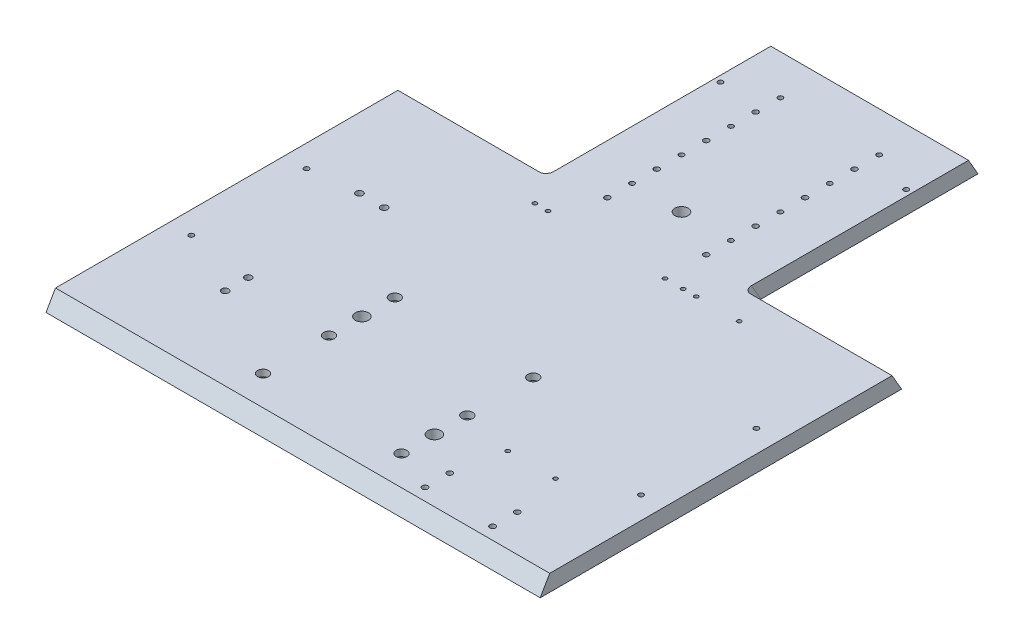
SolidWorks part; units mm, degrees
ref_plane "Front Plane" through (0, 0, 0) normal (0, 0, 1) x (1, 0, 0)
ref_plane "Top Plane" through (0, 0, 0) normal (0, 1, 0) x (1, 0, 0)
ref_plane "Right Plane" through (0, 0, 0) normal (1, 0, 0) x (0, 0, -1)
sketch "Sketch2" plane through (0, 0, 0) normal (0, 1, 0) x (1, 0, 0)
  line L0 (-60, 120) -> (60, 120)
  line L1 (60, 120) -> (60, -16.38)
  line L2 (60, -16.38) -> (150, -16.38)
  line L3 (150, -16.38) -> (150, -235.77)
  line L4 (150, -235.77) -> (-150, -235.77)
  line L5 (-150, -235.77) -> (-150, -16.38)
  line L6 (-150, -16.38) -> (-60, -16.38)
  line L7 (-60, -16.38) -> (-60, 120)
  dimension "D1" = 300
  dimension "D2" = 90
  dimension "D3" = 219.39
  dimension "D4" = 120
  dimension "D5" = 136.38
  dimension "D6" = 150
extrude "Boss-Extrude1" add sketch "Sketch2" along normal blind 10
sketch "Sketch3" plane through (0, 10, 0) normal (0, 1, 0) x (1, 0, 0)
  circle A0 centre (0, 0) radius 4
  dimension "D1" = 8
extrude "Cut-Extrude1" cut sketch "Sketch3" against normal through all
chamfer "Chamfer1" distance 10 angle 30 3 edges at (0, 10, -120) (-105, 10, 16.38) (105, 10, 16.38)
chamfer "Chamfer2" distance 10 angle 30 1 edges at (0, 10, 235.77)
hole_wizard "CBORE for M6 SHCS2" positions "Sketch5" profile "Sketch4" counterbore size "M6" standard "ANSI Metric"
sketch "Sketch5" plane through (0, 0, 0) normal (0, -1, 0) x (-1, 0, 0)
  point P0 (-42, -131.9965)
  point P3 (-42, -171.9965)
  point P6 (-42, -211.9965)
  point P9 (42, -171.9965)
  point P12 (42, -131.9965)
  point P15 (42, -211.9965)
sketch "Sketch4" plane through (42, 0, 131.9965) normal (1, 0, 0) x (0, 0, -1)
  line L0 (0, 0) -> (0, 10)
  line L1 (0, 10) -> (3.3, 10)
  line L3 (3.3, 10) -> (3.3, 6)
  line L4 (3.3, 6) -> (5.5, 6)
  line L5 (5.5, 6) -> (5.5, 0)
  line L7 (5.5, 0) -> (0, 0)
  line L11 (0, -6.35) -> (0, 107.95) construction
  dimension "Thru Hole Dia." = 6.6
  dimension "Thru Hole Depth" = 10
  dimension "C'Bore Dia." = 11
  dimension "C'Bore Depth" = 6
hole_wizard "Ø8.0 (8) Diameter Hole1" positions "Sketch13" profile "Sketch12" hole size "Ø8.0" standard "ANSI Metric"
sketch "Sketch13" plane through (0, 0, 0) normal (0, -1, 0) x (-1, 0, 0)
  line L0 (42, -131.9965) -> (42, -151.9965) construction
  line L2 (-42, -191.9965) -> (-42, -211.9965) construction
  point P0 (-42, -191.9965)
  point P2 (42, -151.9965)
  dimension "D1" = 20
  dimension "D2" = 20
sketch "Sketch12" plane through (42, 0, 191.9965) normal (1, 0, 0) x (0, 0, -1)
  line L0 (0, 0) -> (0, 10)
  line L1 (0, 10) -> (4, 10)
  line L2 (4, 10) -> (4, 0)
  line L5 (4, 0) -> (0, 0)
  line L11 (0, -6.35) -> (0, 107.95) construction
  dimension "Thru Hole Dia." = 8
  dimension "Thru Hole Depth" = 10
hole_wizard "M5x0.8 Tapped Hole1" positions "Sketch15" profile "Sketch14" tap size "M5x0.8" standard "ANSI Metric"
sketch "Sketch15" plane through (0, 10, 0) normal (0, 1, 0) x (1, 0, 0)
  line L0 (-97, -180) -> (-97, -166) construction
  line L2 (-92.5, -88) -> (-107.5, -88) construction
  line L4 (-150, -22.1535) -> (-150, -229.9965) construction
  point P0 (-97, -180)
  point P2 (-97, -166)
  point P4 (-92.5, -88)
  point P6 (-107.5, -88)
  dimension "D1" = 14
  dimension "D2" = 53
  dimension "D3" = 88
  dimension "D4" = 15
  dimension "D5" = 42.5
  dimension "D6" = 166
sketch "Sketch14" plane through (-97, 10, 180) normal (1, 0, 0) x (0, 0, 1)
  line L0 (0, 0) -> (0, 10)
  line L1 (0, 10) -> (2.1, 10)
  line L2 (2.1, 10) -> (2.1, 0)
  line L5 (2.1, 0) -> (0, 0)
  line L11 (0, -6.35) -> (0, 107.95) construction
  dimension "Thru Tap Drill Dia." = 4.2
  dimension "Thru Tap Drill Depth" = 10
hole_wizard "M3x0.5 Tapped Hole1" positions "Sketch24" profile "Sketch23" tap size "M3x0.5" standard "ANSI Metric"
sketch "Sketch24" plane through (0, 0, 0) normal (0, -1, 0) x (-1, 0, 0)
  line L0 (150, -220.5) -> (140, -220.5) construction
  line L1 (150, -16.38) -> (150, -235.77) construction
  line L2 (140, -220.5) -> (140, -31.5) construction
  line L3 (140, -31.5) -> (-140, -31.5) construction
  line L4 (-140, -31.5) -> (-140, -220.5) construction
  line L5 (-140, -220.5) -> (-150, -220.5) construction
  line L6 (-150, -235.77) -> (-150, -16.38) construction
  line L8 (-140, -220.5) -> (140, -220.5) construction
  line L10 (50, 105) -> (-50, 105) construction
  line L11 (-50, 105) -> (-60, 105) construction
  line L12 (-60, -16.38) -> (-60, 120) construction
  line L14 (50, 105) -> (60, 105) construction
  line L15 (60, 120) -> (60, -16.38) construction
  line L17 (-60, 120) -> (60, 120) construction
  point P0 (140, -220.5)
  point P2 (140, -31.5)
  point P4 (-140, -31.5)
  point P6 (-140, -220.5)
  point P8 (50, 105)
  point P10 (-50, 105)
  dimension "D1" = 10
  dimension "D2" = 15
  dimension "D3" = 10
  dimension "D4" = 31.5
  dimension "D5" = 189
sketch "Sketch23" plane through (-140, 0, 220.5) normal (1, 0, 0) x (0, 0, -1)
  line L0 (0, 0) -> (0, 9.2511)
  line L1 (0, 9.2511) -> (1.25, 8.5)
  line L2 (1.25, 8.5) -> (1.25, 0)
  line L5 (1.25, 0) -> (0, 0)
  line L10 (0, 9.2511) -> (-1.25, 8.5) construction
  line L11 (0, -6.35) -> (0, 107.95) construction
  dimension "Tap Drill Dia." = 2.5
  dimension "Tap Drill Depth" = 8.5
  dimension "Drill Angle" = 118
hole_wizard "Ø3.0 (3) Diameter Hole2" positions "Sketch26" profile "Sketch25" hole size "Ø3.0" standard "ANSI Metric"
sketch "Sketch26" plane through (0, 10, 0) normal (0, 1, 0) x (1, 0, 0)
  line L0 (-56.4, 80) -> (56.4, 80) construction
  line L2 (60, -22.1535) -> (60, 114.2265) construction
  line L3 (-60, 114.2265) -> (-60, -22.1535) construction
  point P0 (-56.4, 80)
  point P2 (56.4, 80)
  dimension "D1" = 3.6
  dimension "D2" = 3.6
  dimension "D3" = 80
sketch "Sketch25" plane through (-56.4, 10, -80) normal (1, 0, 0) x (0, 0, 1)
  line L0 (0, 0) -> (0, 10)
  line L1 (0, 10) -> (1.5, 10)
  line L2 (1.5, 10) -> (1.5, 0)
  line L5 (1.5, 0) -> (0, 0)
  line L11 (0, -6.35) -> (0, 107.95) construction
  dimension "Thru Hole Dia." = 3
  dimension "Thru Hole Depth" = 10
hole_wizard "Ø3.0 (3) Diameter Hole3" positions "Sketch30" profile "Sketch29" hole size "Ø3.0" standard "ANSI Metric"
sketch "Sketch30" plane through (0, 10, 0) normal (0, 1, 0) x (1, 0, 0)
  line L0 (-30, 0) -> (0, 0) construction
  line L1 (0, 0) -> (30, 0) construction
  point P0 (-30, 0)
  point P2 (30, 0)
  dimension "D1" = 30
sketch "Sketch29" plane through (-30, 10, 0) normal (1, 0, 0) x (0, 0, 1)
  line L0 (0, 0) -> (0, 10)
  line L1 (0, 10) -> (1.5, 10)
  line L2 (1.5, 10) -> (1.5, 0)
  line L5 (1.5, 0) -> (0, 0)
  line L11 (0, -6.35) -> (0, 107.95) construction
  dimension "Thru Hole Dia." = 3
  dimension "Thru Hole Depth" = 10
hole_wizard "M4x0.7 Tapped Hole1" positions "Sketch32" profile "Sketch31" tap size "M4x0.7" standard "ANSI Metric"
sketch "Sketch32" plane through (0, 10, 0) normal (0, 1, 0) x (1, 0, 0)
  line L0 (-30, 0) -> (-30, -15) construction
  line L1 (-30, -15) -> (30, -15) construction
  line L2 (30, -15) -> (30, 0) construction
  point P0 (-30, -15)
  point P2 (30, -15)
  dimension "D1" = 15
sketch "Sketch31" plane through (-30, 10, 15) normal (1, 0, 0) x (0, 0, 1)
  line L0 (0, 0) -> (0, 10)
  line L1 (0, 10) -> (1.65, 10)
  line L2 (1.65, 10) -> (1.65, 0)
  line L5 (1.65, 0) -> (0, 0)
  line L11 (0, -6.35) -> (0, 107.95) construction
  dimension "Thru Tap Drill Dia." = 3.3
  dimension "Thru Tap Drill Depth" = 10
pattern_linear "LPattern1" count 4 spacing 30 along (0, 0, -1) of "Ø3.0 (3) Diameter Hole3", "M4x0.7 Tapped Hole1"
fillet "Fillet1" radius 4 2 edges at (60, 5, 19.2668) (-60, 5, 19.2668)
hole_wizard "CSK for M3 Flat Head Machine Screw1" positions "Sketch34" profile "Sketch33" countersink size "M3" standard "ANSI Metric"
sketch "Sketch34" plane through (0, 0, 0) normal (0, -1, 0) x (-1, 0, 0)
  point P0 (-108, -207.676)
  point P3 (-108, -222.676)
  point P6 (-67, -222.676)
  point P9 (-67, -207.676)
sketch "Sketch33" plane through (108, 0, 207.676) normal (1, 0, 0) x (0, 0, -1)
  line L0 (0, 0) -> (0, 10)
  line L1 (0, 10) -> (1.7, 10)
  line L2 (1.7, 10) -> (1.7, 1.45)
  line L3 (1.7, 1.45) -> (3.15, 0)
  line L5 (3.15, 0) -> (0, 0)
  line L6 (-1.7, 1.45) -> (-3.15, 0) construction
  line L11 (0, -6.35) -> (0, 107.95) construction
  dimension "Thru Hole Dia." = 3.4
  dimension "Thru Hole Depth" = 10
  dimension "Near C'Sink Dia." = 6.3
  dimension "Near C'Sink Angle" = 90
hole_wizard "M3x0.5 Tapped Hole3" positions "Sketch36" profile "Sketch35" tap size "M3x0.5" standard "ANSI Metric"
sketch "Sketch36" plane through (0, 0, 0) normal (0, -1, 0) x (-1, 0, 0)
  point P0 (-102, -178.4765)
  point P3 (-73, -178.4765)
sketch "Sketch35" plane through (102, 0, 178.4765) normal (1, 0, 0) x (0, 0, -1)
  line L0 (0, 0) -> (0, 10)
  line L1 (0, 10) -> (1.25, 10)
  line L2 (1.25, 10) -> (1.25, 0)
  line L5 (1.25, 0) -> (0, 0)
  line L11 (0, -6.35) -> (0, 107.95) construction
  dimension "Thru Tap Drill Dia." = 2.5
  dimension "Thru Tap Drill Depth" = 10
hole_wizard "Ø3.0 (3) Diameter Hole4" positions "Sketch40" profile "Sketch39" hole size "Ø3.0" standard "ANSI Metric"
sketch "Sketch40" plane through (0, 0, 0) normal (0, -1, 0) x (-1, 0, 0)
  line L4 (-136.5, -86.9734) -> (-136.5, -91.0734) construction
  line L5 (-136.5, -91.0734) -> (-136.5, -95.1734) construction
  line L7 (-136.5, -156.9734) -> (-136.5, -161.0734) construction
  line L8 (-136.5, -161.0734) -> (-136.5, -165.1734) construction
  line L9 (136.5, -86.9734) -> (136.5, -91.0734) construction
  line L11 (136.5, -156.9734) -> (136.5, -161.0734) construction
  arc A4 (-134.9, -88.5734) -> (-138.1, -88.5734) centre (-136.5, -88.5734) ccw construction
  arc A5 (-138.1, -93.5734) -> (-134.9, -93.5734) centre (-136.5, -93.5734) ccw construction
  arc A6 (-134.9, -158.5734) -> (-138.1, -158.5734) centre (-136.5, -158.5734) ccw construction
  arc A7 (-138.1, -163.5734) -> (-134.9, -163.5734) centre (-136.5, -163.5734) ccw construction
  arc A8 (138.1, -88.5734) -> (134.9, -88.5734) centre (136.5, -88.5734) ccw construction
  arc A9 (138.1, -158.5734) -> (134.9, -158.5734) centre (136.5, -158.5734) ccw construction
  point P0 (-136.5, -91.0734)
  point P2 (-136.5, -161.0734)
  point P45 (136.5, -91.0734)
  point P47 (136.5, -161.0734)
  dimension "D1" = 4.1
  dimension "D2" = 4.1
  dimension "D3" = 4.1
  dimension "D4" = 4.1
sketch "Sketch39" plane through (136.5, 0, 91.0734) normal (1, 0, 0) x (0, 0, -1)
  line L0 (0, 0) -> (0, 10)
  line L1 (0, 10) -> (1.5, 10)
  line L2 (1.5, 10) -> (1.5, 0)
  line L5 (1.5, 0) -> (0, 0)
  line L11 (0, -6.35) -> (0, 107.95) construction
  dimension "Thru Hole Dia." = 3
  dimension "Thru Hole Depth" = 10
hole_wizard "M3x0.5 Tapped Hole5" positions "Sketch42" profile "Sketch41" tap size "M3x0.5" standard "ANSI Metric"
sketch "Sketch42" plane through (0, 0, 0) normal (0, -1, 0) x (-1, 0, 0)
  line L1 (-75, -40) -> (-30, -40) construction
  line L2 (-150, -235.77) -> (-150, -16.38) construction
  circle A0 centre (0, 0) radius 4 construction
  point P0 (-75, -40)
  point P6 (-30, -40)
  dimension "D1" = 75
  dimension "D2" = 45
  dimension "D3" = 40
sketch "Sketch41" plane through (75, 0, 40) normal (1, 0, 0) x (0, 0, -1)
  line L0 (0, 0) -> (0, 10)
  line L1 (0, 10) -> (1.25, 10)
  line L2 (1.25, 10) -> (1.25, 0)
  line L5 (1.25, 0) -> (0, 0)
  line L11 (0, -6.35) -> (0, 107.95) construction
  dimension "Thru Tap Drill Dia." = 2.5
  dimension "Thru Tap Drill Depth" = 10
hole_wizard "M3x0.5 Tapped Hole6" positions "Sketch44" profile "Sketch43" tap size "M3x0.5" standard "ANSI Metric"
sketch "Sketch44" plane through (0, 0, 0) normal (0, -1, 0) x (-1, 0, 0)
  point P0 (-41, -40)
  point P3 (-49, -40)
  point P6 (41, -40)
  point P9 (49, -40)
sketch "Sketch43" plane through (41, 0, 40) normal (1, 0, 0) x (0, 0, -1)
  line L0 (0, 0) -> (0, 10)
  line L1 (0, 10) -> (1.25, 10)
  line L2 (1.25, 10) -> (1.25, 0)
  line L5 (1.25, 0) -> (0, 0)
  line L11 (0, -6.35) -> (0, 107.95) construction
  dimension "Thru Tap Drill Dia." = 2.5
  dimension "Thru Tap Drill Depth" = 10
